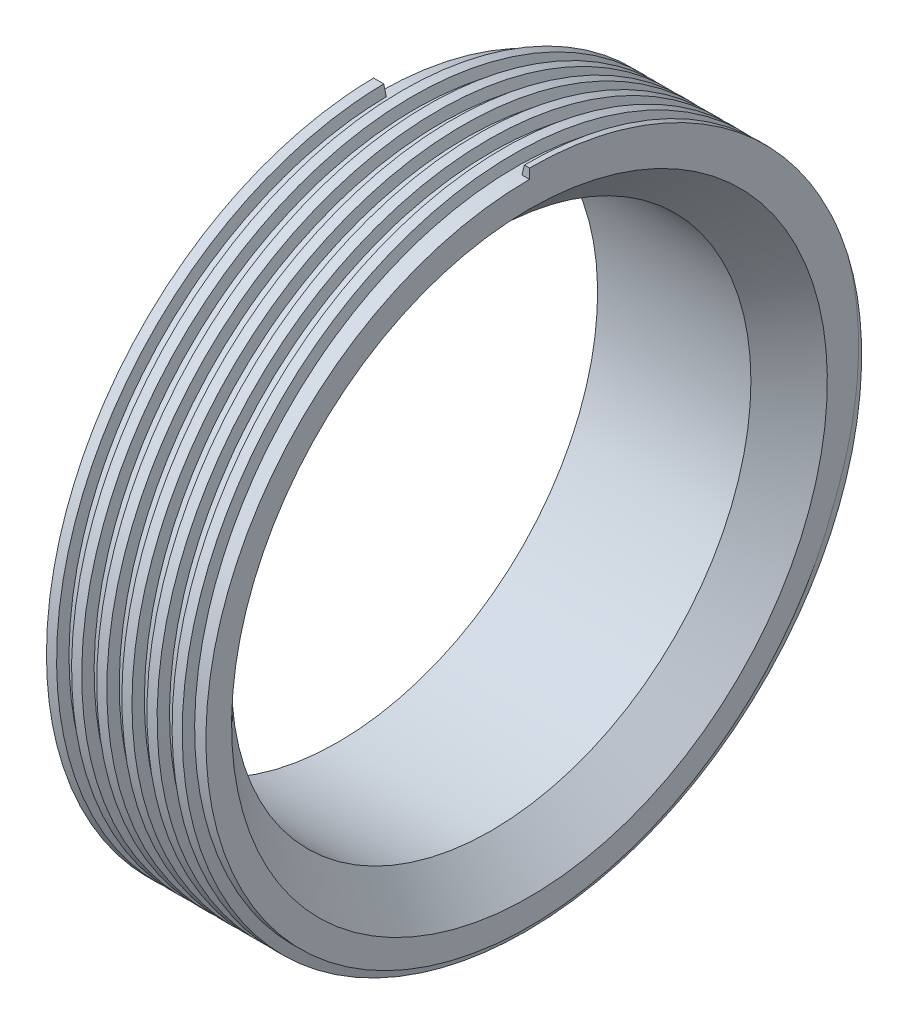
SolidWorks part; units mm, degrees
ref_plane "Front Plane" through (0, 0, 0) normal (0, 0, 1) x (1, 0, 0)
ref_plane "Top Plane" through (0, 0, 0) normal (0, 1, 0) x (1, 0, 0)
ref_plane "Right Plane" through (0, 0, 0) normal (1, 0, 0) x (0, 0, -1)
sketch "Sketch1" plane through (0, 0, 0) normal (0, 0, 1) x (1, 0, 0)
  line L0 (0, 0) -> (0, 31.75)
  line L1 (0, 31.75) -> (1.5494, 31.75)
  line L2 (4.7244, 34.925) -> (4.7244, 38.6461)
  line L3 (4.7244, 38.6461) -> (22.1996, 38.6461)
  line L4 (22.1996, 38.6461) -> (22.1996, 0)
  line L5 (22.1996, 0) -> (0, 0)
  arc A0 (4.7244, 34.925) -> (1.5494, 31.75) centre (1.5494, 34.925) cw
  dimension ".125" = 3.175
  dimension "D1" = 31.75
  dimension "D2" = 17.4752
  dimension "D3" = 22.1996
  dimension "D4" = 38.6461
revolve "Revolve1" add sketch "Sketch1" angle 360 about L5
sketch "Sketch3" plane through (22.1996, 0, 0) normal (1, 0, 0) x (0, 0, -1)
  circle A1 centre (0, 0) radius 38.6461
  circle A2 centre (0, 0) radius 38.6461
  dimension "D1" = 0
curve "Helix/Spiral1"
sketch "Sketch10" plane through (22.1996, 0, 0) normal (1, 0, 0) x (0, 0, -1)
  circle A2 centre (0, 0) radius 37.5031
  circle A3 centre (0, 0) radius 37.5031
  dimension "D1" = 1.143
extrude "Cut-Extrude14" cut sketch "Sketch10" against normal blind 17.4752 flip side to cut
sketch "Sketch13" plane through (0, 0, 0) normal (0, 1, 0) x (1, 0, 0)
  line L0 (17.9709, 38.6459) -> (19.1469, 38.6459)
  line L1 (19.1469, 38.6459) -> (19.6232, 36.8044)
  line L2 (19.6232, 36.8044) -> (17.4947, 36.8044)
  line L3 (17.4947, 36.8044) -> (17.9709, 38.6459)
  line L4 (18.5589, 38.6459) -> (18.5589, 21.2583) construction
  dimension "D1" = 1.8415
  dimension "D2" = 1.176
  dimension "D3" = 14.5
  dimension "D4" = 14.5
sweep "Sweep1" add profiles "Sketch13" path "Helix/Spiral1"
sketch "Sketch15" plane through (0, 0, 0) normal (0, 0, 1) x (1, 0, 0)
  line L1 (22.1996, -37.5031) -> (27.9826, -37.5031)
  line L2 (22.1996, -37.5031) -> (22.1996, 39.0398)
  line L3 (22.1996, 39.0398) -> (27.9826, 39.0398)
  line L4 (27.9826, -37.5031) -> (27.9826, 39.0398)
extrude "Cut-Extrude15" cut sketch "Sketch15" against normal blind 38.1
sketch "Sketch16" plane through (0, 0, 0) normal (-1, 0, 0) x (0, 0, 1)
  circle A0 centre (0, 0) radius 30.099
extrude "Cut-Extrude16" cut sketch "Sketch16" against normal blind 22.225
chamfer "Chamfer1" distance 4.4298 angle 45 1 edges at (22.1996, 30.099, 0)
sketch "Sketch17" plane through (0, 0, 0) normal (0, 0, 1) x (1, 0, 0)
  line L1 (22.1996, -37.5031) -> (33.645, -37.5031)
  line L2 (22.1996, -37.5031) -> (22.1996, 44.2008)
  line L3 (22.1996, 44.2008) -> (33.645, 44.2008)
  line L4 (33.645, -37.5031) -> (33.645, 44.2008)
extrude "Cut-Extrude17" cut sketch "Sketch17" against normal mid plane 88.9
